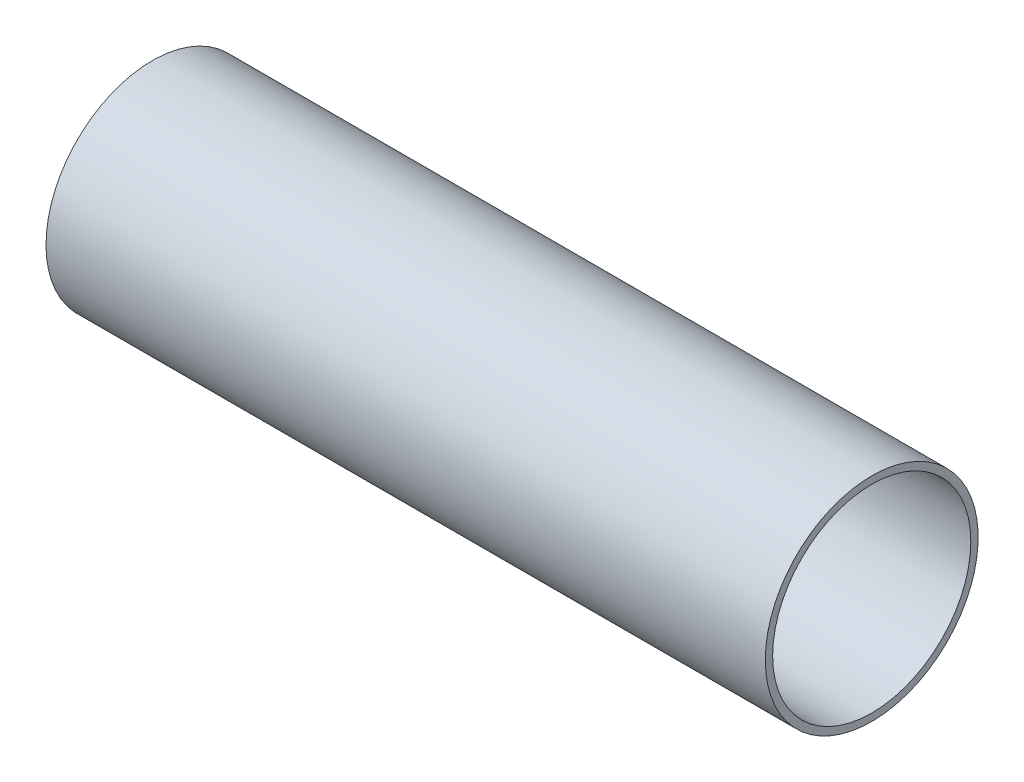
SolidWorks part; units mm, degrees
ref_plane "Face" through (0, 0, 0) normal (0, 0, 1) x (1, 0, 0)
ref_plane "Dessus" through (0, 0, 0) normal (0, 1, 0) x (1, 0, 0)
ref_plane "Droite" through (0, 0, 0) normal (1, 0, 0) x (0, 0, -1)
sketch "Esquisse1" plane through (0, 0, 0) normal (0, 0, 1) x (1, 0, 0)
  line L0 (-5.2734, 0) -> (48.0579, 0) construction
  line L2 (0, 27) -> (196, 27)
  line L3 (0, 27) -> (0, 29)
  line L4 (0, 29) -> (196, 29)
  line L5 (196, 27) -> (196, 29)
  dimension "D1" = 54
  dimension "D2" = 58
  dimension "D3" = 196
revolve "Révolution1" add sketch "Esquisse1" angle 360 about L0
